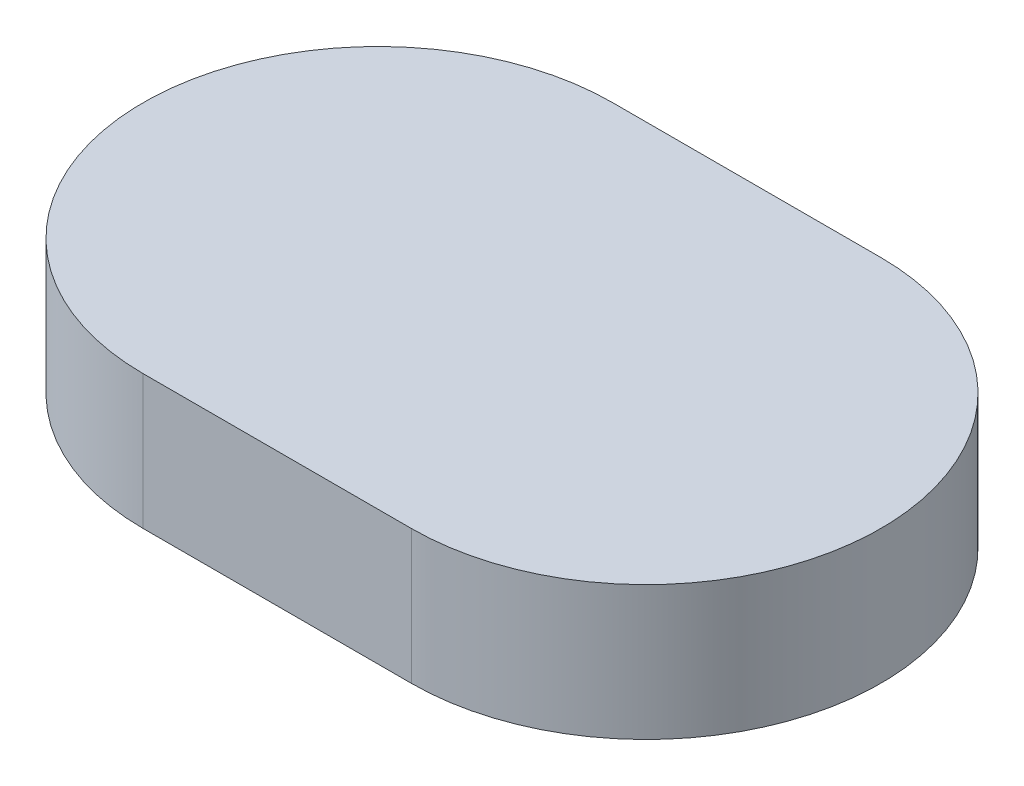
SolidWorks part; units mm, degrees
ref_plane "Plan de face" through (0, 0, 0) normal (0, 0, 1) x (1, 0, 0)
ref_plane "Plan de dessus" through (0, 0, 0) normal (0, 1, 0) x (1, 0, 0)
ref_plane "Plan de droite" through (0, 0, 0) normal (1, 0, 0) x (0, 0, -1)
sketch "Esquisse1" plane through (0, 0, 0) normal (0, 1, 0) x (1, 0, 0)
  line L0 (-2, 0) -> (2, 0) construction
  line L1 (-2, 3.5) -> (2, 3.5)
  line L2 (-2, -3.5) -> (2, -3.5)
  arc A0 (-2, 3.5) -> (-2, -3.5) centre (-2, 0) ccw
  arc A1 (2, -3.5) -> (2, 3.5) centre (2, 0) ccw
  point P2 (0, 0)
  dimension "D2" = 3.5
  dimension "D1" = 4
extrude "Boss.-Extru.1" add sketch "Esquisse1" along normal blind 2
